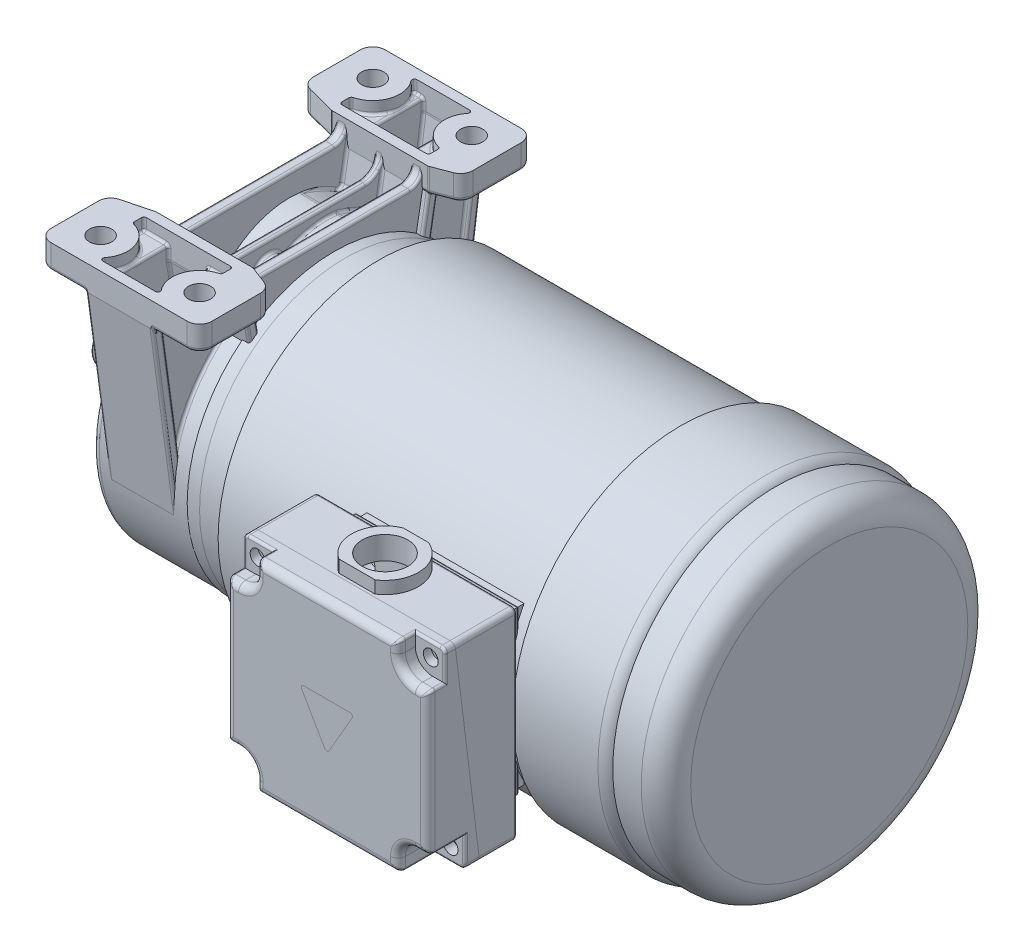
SolidWorks part; units mm, degrees
ref_plane "前视基准面" through (0, 0, 0) normal (0, 0, 1) x (1, 0, 0)
ref_plane "上视基准面" through (0, 0, 0) normal (0, 1, 0) x (1, 0, 0)
ref_plane "右视基准面" through (0, 0, 0) normal (1, 0, 0) x (0, 0, -1)
imported_body "接线盒座-1-surface1"
imported_body "接线盒座-1-surface2"
imported_body "接线盒座-1-surface3"
imported_body "接线盒座-1-surface4"
imported_body "接线盒座-1-surface5"
imported_body "接线盒座-1-surface6"
imported_body "接线盒座-1-surface7"
imported_body "接线盒座-1-surface8"
imported_body "接线盒盖-1-surface1"
imported_body "接线盒盖-1-surface2"
imported_body "接线盒盖-1-surface3"
imported_body "接线盒盖-1-surface4"
imported_body "15.11.08 18B卧式装配体200-1-surface1"
imported_body "15.11.08 18B卧式装配体200-1-surface2"
imported_body "15.11.08 18B卧式装配体200-1-surface3"
imported_body "15.11.08 18B卧式装配体200-1-surface4"
imported_body "15.11.08 18B卧式装配体200-1-surface5"
imported_body "15.11.08 18B卧式装配体200-1-surface6"
imported_body "透气塞-1-surface1"
imported_body "GB／T1096-1979普通平键A型5×25-1-surface1"
sketch "草图1" plane through (-67.9473, 0, 0) normal (1, 0, 0) x (0, 0, -1)
  circle A2 centre (4.61, -126.7652) radius 65
extrude "凸台-拉伸1" add sketch "草图1" along normal blind 122
sketch "草图2" plane through (54.0527, 0, 0) normal (1, 0, 0) x (0, 0, -1)
  circle A0 centre (4.61, -126.7652) radius 68
extrude "凸台-拉伸2" add sketch "草图2" along normal blind 33.5 separate body
sketch "草图3" plane through (87.5527, 0, 0) normal (1, 0, 0) x (0, 0, -1)
  circle A0 centre (4.61, -126.7652) radius 68
extrude "凸台-拉伸3" add sketch "草图3" along normal blind 5
sketch "草图4" plane through (92.5527, 0, 0) normal (1, 0, 0) x (0, 0, -1)
  circle A0 centre (4.61, -126.7652) radius 66
extrude "凸台-拉伸4" add sketch "草图4" along normal blind 21.5
fillet "圆角1" radius 10 1 edges at (114.0527, -126.7652, -70.61)
fillet "圆角3" radius 5 1 edges at (92.5527, -126.7652, -72.61)
